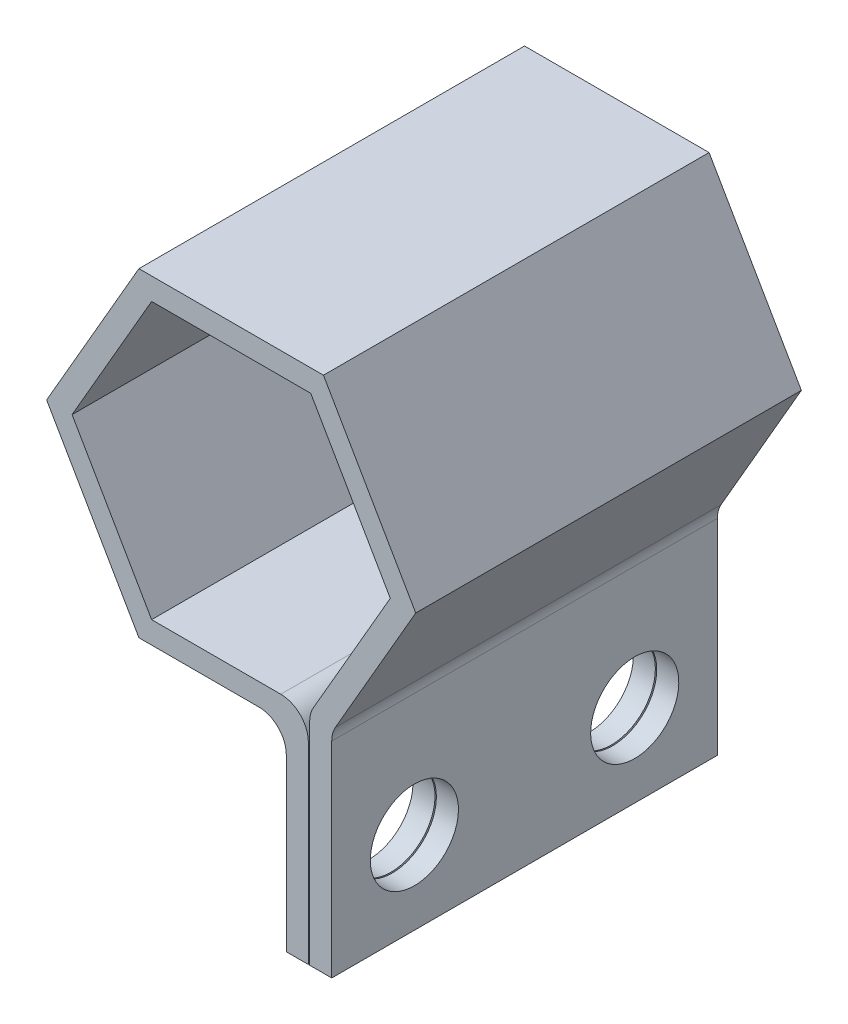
SolidWorks part; units mm, degrees
ref_plane "Front Plane" through (0, 0, 0) normal (0, 0, 1) x (1, 0, 0)
ref_plane "Top Plane" through (0, 0, 0) normal (0, 1, 0) x (1, 0, 0)
ref_plane "Right Plane" through (0, 0, 0) normal (1, 0, 0) x (0, 0, -1)
sketch "Sketch1" plane through (0, 0, 0) normal (0, 0, 1) x (1, 0, 0)
  line L0 (-2.8881, 5.0024) -> (-5.7762, 0)
  line L1 (6.7, 0) -> (3.35, 5.8024)
  line L2 (3.35, 5.8024) -> (-3.35, 5.8024)
  line L3 (-3.35, 5.8024) -> (-6.7, 0)
  line L4 (-6.7, 0) -> (-3.35, -5.8024)
  line L5 (-3.35, -5.8024) -> (1, -5.8024)
  line L6 (3.784, -5.0507) -> (6.7, 0)
  line L7 (-5.7762, 0) -> (-2.8881, -5.0024)
  line L8 (-2.8881, -5.0024) -> (1.8, -5.0024)
  line L9 (2.984, -4.8363) -> (5.7762, 0)
  line L10 (5.7762, 0) -> (2.8881, 5.0024)
  line L11 (2.8881, 5.0024) -> (-2.8881, 5.0024)
  line L12 (0, 0) -> (-8.2458, 0) construction
  line L13 (0, 0) -> (0, -5.8024) construction
  line L14 (2, -6.8024) -> (2, -13)
  line L15 (2.8, -6.0024) -> (2.8, -13)
  line L16 (2.85, -5.3363) -> (2.85, -13)
  line L17 (3.65, -5.5507) -> (3.65, -13)
  line L18 (3.65, -13) -> (2.85, -13)
  line L19 (0, -13) -> (-8.2458, -13) construction
  line L20 (3.65, 0) -> (3.65, -5.8024) construction
  line L21 (2.8, 0) -> (2.8, -5.8024) construction
  line L22 (2.85, 0) -> (2.85, -5.8024) construction
  line L23 (2, 0) -> (2, -5.8024) construction
  line L24 (3.35, -5.8024) -> (6.7, 0) construction
  line L25 (-3.35, -5.8024) -> (3.35, -5.8024) construction
  line L26 (-2.8881, -5.0024) -> (2.8881, -5.0024) construction
  line L27 (2.8881, -5.0024) -> (5.7762, 0) construction
  line L28 (2.8, -13) -> (2, -13)
  circle A0 centre (0, 0) radius 5.8024 construction
  arc A1 (3.784, -5.0507) -> (3.65, -5.5507) centre (4.65, -5.5507) ccw
  arc A2 (2.984, -4.8363) -> (2.85, -5.3363) centre (3.85, -5.3363) ccw
  arc A3 (1.8, -5.0024) -> (2.8, -6.0024) centre (1.8, -6.0024) cw
  arc A4 (1, -5.8024) -> (2, -6.8024) centre (1, -6.8024) cw
  dimension "D8" = 1
  dimension "D1" = 13.4
  dimension "D2" = 0.8
  dimension "D3" = 2
  dimension "D4" = 0.8
  dimension "D5" = 0.05
  dimension "D6" = 0.8
  dimension "D7" = 13
extrude "Boss-Extrude1" add sketch "Sketch1" along normal blind 14
sketch "Sketch2" plane through (3.65, 0, 0) normal (1, 0, 0) x (0, 0, -1)
  line L0 (-14, -13) -> (-14, -5.5507) construction
  line L1 (0, 0) -> (-18.3007, 0) construction
  circle A0 centre (-11, -10) radius 1.6
  circle A1 centre (-3, -10) radius 1.6
  dimension "D3" = 3.2
  dimension "D1" = 3
  dimension "D2" = 10
  dimension "D4" = 8
extrude "Cut-Extrude1" cut sketch "Sketch2" against normal up to surface (1.65 mm away)
